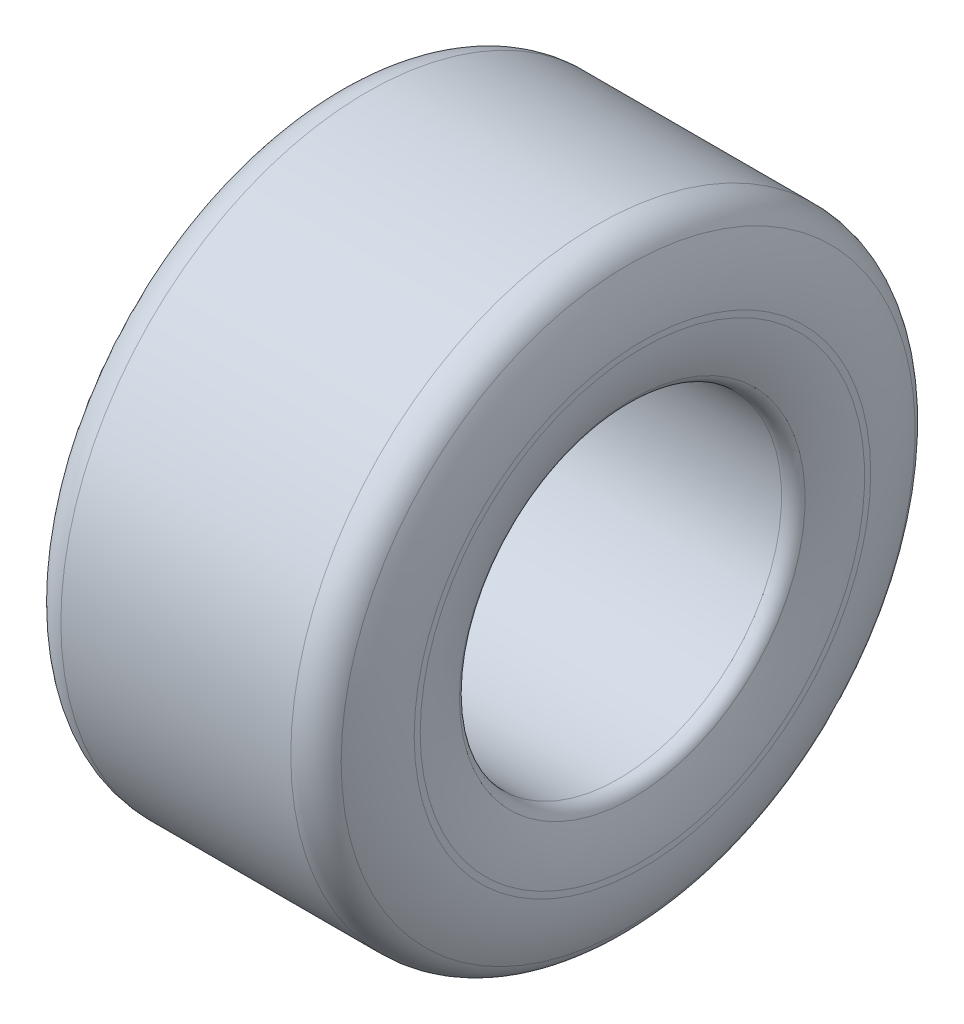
SolidWorks part; units mm, degrees
ref_plane "Front Plane" through (0, 0, 0) normal (0, 0, 1) x (1, 0, 0)
ref_plane "Top Plane" through (0, 0, 0) normal (0, 1, 0) x (1, 0, 0)
ref_plane "Right Plane" through (0, 0, 0) normal (1, 0, 0) x (0, 0, -1)
sketch "Sketch1" plane through (0, 0, 0) normal (0, 0, 1) x (1, 0, 0)
  line L0 (0, 0) -> (153.1434, 0) construction
  line L1 (0, 0) -> (0, 89.2481) construction
  line L2 (57.15, 68.58) -> (-57.15, 68.58)
  line L3 (-67.31, 93.297) -> (-67.31, 95.837)
  line L4 (-48.26, 128.5875) -> (48.26, 128.5875)
  line L5 (67.31, 93.297) -> (67.31, 95.837)
  line L6 (-67.31, 94.567) -> (-8.6386, 94.567) construction
  arc A0 (-57.15, 68.58) -> (-63.0361, 72.5474) centre (-57.15, 74.93) cw
  arc A1 (-61.2967, 120.4721) -> (-48.26, 128.5875) centre (-48.26, 114.0587) cw
  arc A2 (48.26, 128.5875) -> (61.2967, 120.4721) centre (48.26, 114.0587) cw
  arc A3 (63.0361, 72.5474) -> (57.15, 68.58) centre (57.15, 74.93) cw
  arc A4 (-61.2967, 120.4721) -> (-67.31, 95.837) centre (-8.6386, 94.567) ccw
  arc A5 (63.0361, 72.5474) -> (67.31, 93.297) centre (8.6386, 94.567) ccw
  arc A6 (-67.31, 93.297) -> (-63.0361, 72.5474) centre (-8.6386, 94.567) ccw
  arc A9 (67.31, 95.837) -> (61.2967, 120.4721) centre (8.6386, 94.567) ccw
  dimension "D3" = 6.35
  dimension "D4" = 14.5288
  dimension "D5" = 134.62
  dimension "D1" = 137.16
  dimension "D2" = 257.175
  dimension "D6" = 96.52
  dimension "D8" = 114.3
  dimension "D10" = 2.54
revolve "Revolve1" add sketch "Sketch1" angle 360 about L0
